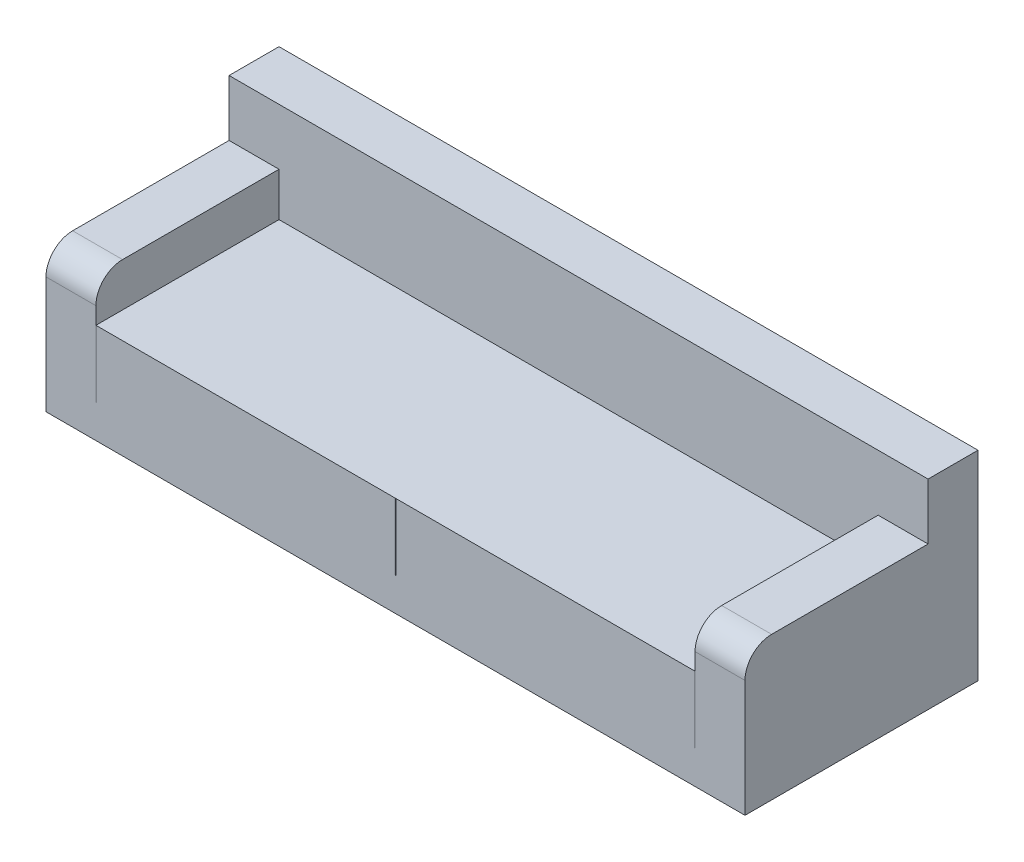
SolidWorks part; units mm, degrees
ref_plane "Plan de face" through (0, 0, 0) normal (0, 0, 1) x (1, 0, 0)
ref_plane "Plan de dessus" through (0, 0, 0) normal (0, 1, 0) x (1, 0, 0)
ref_plane "Plan de droite" through (0, 0, 0) normal (1, 0, 0) x (0, 0, -1)
sketch "Esquisse1" plane through (0, 0, 0) normal (0, 1, 0) x (1, 0, 0)
  line L1 (-450, 275) -> (450, 275)
  line L2 (-450, 275) -> (-450, -275)
  line L3 (-450, -275) -> (450, -275)
  line L4 (450, 275) -> (450, -275)
  line L5 (-450, 275) -> (450, -275) construction
  line L6 (-450, -275) -> (450, 275) construction
  point P0 (0, 0)
  dimension "D1" = 900
  dimension "D2" = 550
extrude "Boss.-Extru.1" add sketch "Esquisse1" along normal blind 200
fillet "Congé1" radius 1 4 edges at (-450, 100, 275) (-450, 100, -275) (450, 100, -275) (450, 100, 275)
pattern_linear "Répétition linéaire3" count 2 spacing 900 along (1, 0, 0) of "Boss.-Extru.1", "Congé1"
sketch "Esquisse2" plane through (0, 0, 0) normal (0, -1, 0) x (1, 0, 0)
  line L0 (-449, 275) -> (449, 275) construction
  line L1 (1500, 275) -> (-600, 275)
  line L2 (1500, 275) -> (1500, -275)
  line L3 (1500, -275) -> (-600, -275)
  line L4 (-600, 275) -> (-600, -275)
  line L5 (1500, 275) -> (-600, -275) construction
  line L6 (1500, -275) -> (-600, 275) construction
  line L7 (449, -275) -> (-449, -275) construction
  line L8 (-450, -274) -> (-450, 274) construction
  line L9 (1350, 274) -> (1350, -274) construction
  point P0 (450, 0)
  dimension "D1" = 150
  dimension "D2" = 150
extrude "Boss.-Extru.2" add sketch "Esquisse2" along normal blind 100
sketch "Esquisse3" plane through (0, 0, 0) normal (0, 1, 0) x (1, 0, 0)
  line L1 (1500, 275) -> (1350, 275)
  line L2 (1500, 275) -> (1500, -275)
  line L3 (1500, -275) -> (1350, -275)
  line L4 (1350, 275) -> (1350, -275)
  line L5 (-449, -275) -> (-600, -275) construction
  line L6 (-600, 275) -> (-450, 275)
  line L7 (-600, 275) -> (-600, -275)
  line L8 (-600, -275) -> (-450, -275)
  line L9 (-450, 275) -> (-450, -275)
  line L10 (-450, 274) -> (-450, -274) construction
  line L12 (1500, -275) -> (1349, -275) construction
  line L13 (1350, -274) -> (1350, 274) construction
extrude "Boss.-Extru.3" add sketch "Esquisse3" along normal blind 331
fillet "Congé2" radius 80 2 edges at (1425, 331, 275) (-525, 331, 275)
sketch "Esquisse4" plane through (0, 0, -275) normal (0, 0, -1) x (-1, 0, 0)
  line L0 (-1500, -100) -> (-1500, 331) construction
  line L1 (600, -100) -> (-1500, -100)
  line L2 (600, -100) -> (600, 500)
  line L3 (600, 500) -> (-1500, 500)
  line L4 (-1500, -100) -> (-1500, 500)
  line L5 (600, -100) -> (-1500, -100) construction
  dimension "D1" = 600
extrude "Boss.-Extru.4" add sketch "Esquisse4" along normal blind 150
sketch "Esquisse5" plane through (0, -100, 0) normal (0, -1, 0) x (1, 0, 0)
  line L0 (1500, 275) -> (-600, 275) construction
  line L1 (-600, 275) -> (-600, -425) construction
  line L2 (1500, -425) -> (-600, -425) construction
  line L3 (1500, -425) -> (1500, 275) construction
  circle A0 centre (-500, 175) radius 50
  circle A1 centre (1400, 175) radius 50
  circle A2 centre (1400, -325) radius 50
  circle A3 centre (-500, -325) radius 50
  dimension "D1" = 100
  dimension "D3" = 100
  dimension "D4" = 100
  dimension "D5" = 100
  dimension "D6" = 100
  dimension "D8" = 100
  dimension "D9" = 100
  dimension "D10" = 100
  dimension "D11" = 100
  dimension "D12" = 100
  dimension "D2" = 100
  dimension "D7" = 100
extrude "Boss.-Extru.5" add sketch "Esquisse5" along normal blind 50
